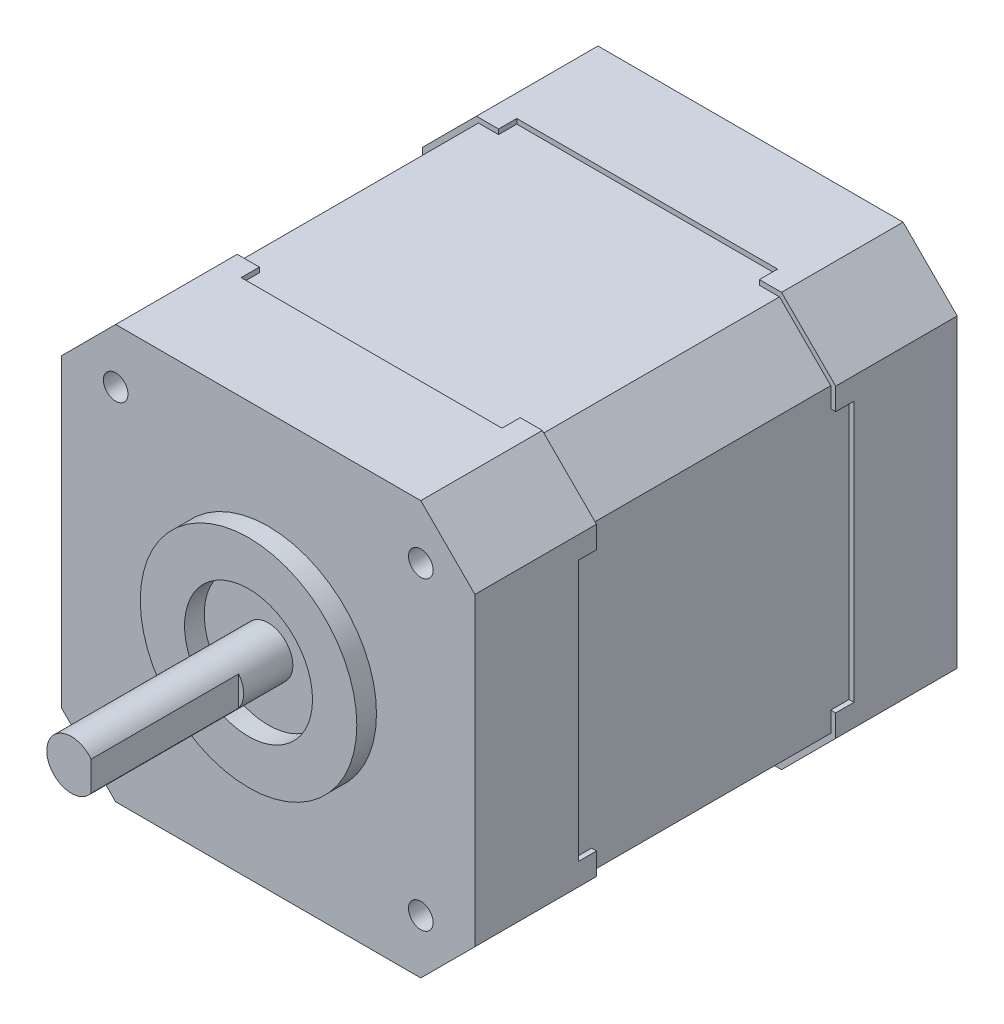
SolidWorks part; units mm, degrees
ref_plane "前基準面" through (0, 0, 0) normal (0, 0, 1) x (1, 0, 0)
ref_plane "上基準面" through (0, 0, 0) normal (0, 1, 0) x (1, 0, 0)
ref_plane "右基準面" through (0, 0, 0) normal (1, 0, 0) x (0, 0, -1)
sketch "草圖1" plane through (0, 0, 0) normal (0, 0, 1) x (1, 0, 0)
  line L0 (-21, 15.5) -> (-15.5, 21)
  line L1 (-15.5, 21) -> (15.5, 21)
  line L2 (-21, 15.5) -> (-21, -15.5)
  line L3 (-15.5, -21) -> (15.5, -21)
  line L4 (21, 15.5) -> (21, -15.5)
  line L5 (-18.25, 18.25) -> (18.25, -18.25) construction
  line L6 (-18.25, -18.25) -> (18.25, 18.25) construction
  line L7 (-21, -15.5) -> (-15.5, -21)
  line L8 (15.5, -21) -> (21, -15.5)
  line L9 (15.5, 21) -> (21, 15.5)
  point P0 (0, 0)
  dimension "D1" = 42
  dimension "D2" = 21
  dimension "D3" = 42
  dimension "D4" = 21
  dimension "D5" = 5.5
  dimension "D6" = 5.5
  dimension "D7" = 31
  dimension "D8" = 5.5
  dimension "D9" = 31
  dimension "D10" = 5.5
  dimension "D11" = 31
  dimension "D12" = 31
extrude "填料-伸長1" add sketch "草圖1" against normal blind 49
sketch "草圖2" plane through (0, 0, 0) normal (0, 0, 1) x (1, 0, 0)
  circle A0 centre (0, 0) radius 11
  circle A1 centre (0, 0) radius 6.5
  dimension "D1" = 22
  dimension "D2" = 13
extrude "填料-伸長2" add sketch "草圖2" along normal blind 2
sketch "草圖3" plane through (0, 0, 0) normal (0, 0, 1) x (1, 0, 0)
  circle A0 centre (0, 0) radius 2.5
  dimension "D1" = 5
extrude "填料-伸長3" add sketch "草圖3" along normal blind 20
sketch "草圖4" plane through (0, 0, 20) normal (0, 0, 1) x (1, 0, 0)
  line L0 (2, 1.5) -> (2, -1.5)
  arc A0 (2, -1.5) -> (2, 1.5) centre (0, 0) ccw
  dimension "D1" = 5
  dimension "D3" = 2
extrude "除料-伸長1" cut sketch "草圖4" against normal blind 15
ref_plane "平面1" through (0, 0, -12.35) normal (0, 0, 1) x (1, 0, 0)
sketch "草圖5" plane through (0, 0, -12.35) normal (0, 0, 1) x (1, 0, 0)
  line L0 (15.5, 21) -> (-15.5, 21) construction
  line L1 (21, 15.5) -> (15.5, 21) construction
  line L2 (21, -15.5) -> (21, 15.5) construction
  line L3 (15.5, -21) -> (21, -15.5) construction
  line L4 (-15.5, -21) -> (15.5, -21) construction
  line L5 (-21, -15.5) -> (-15.5, -21) construction
  line L6 (-21, 15.5) -> (-21, -15.5) construction
  line L7 (-15.5, 21) -> (-21, 15.5) construction
  line L8 (15.5, 21) -> (-15.5, 21)
  line L9 (21, 15.5) -> (15.5, 21)
  line L10 (21, -15.5) -> (21, 15.5)
  line L11 (15.5, -21) -> (21, -15.5)
  line L12 (-15.5, -21) -> (15.5, -21)
  line L13 (-21, -15.5) -> (-15.5, -21)
  line L14 (-21, 15.5) -> (-21, -15.5)
  line L15 (-15.5, 21) -> (-21, 15.5)
sketch "草圖6" plane through (0, 0, 0) normal (1, 0, 0) x (0, 0, -1)
  line L0 (12.35, 21) -> (12.35, 15.5) construction
  line L1 (12.35, 21) -> (36.65, 21)
  line L2 (12.35, 21) -> (12.35, 20.5)
  line L3 (12.35, 20.5) -> (36.65, 20.5)
  line L4 (36.65, 21) -> (36.65, 20.5)
  line L5 (49, 21) -> (0, 21) construction
  line L7 (49, 15.5) -> (49, 21) construction
  dimension "D1" = 0.5
  dimension "D2" = 12.35
sweep "除料-掃出1" cut profiles "草圖6" path "草圖5"
sketch "草圖7" plane through (0, 21, 0) normal (0, 1, 0) x (1, 0, 0)
  line L0 (15.5, 0) -> (-15.5, 0) construction
  line L1 (-13.25, 38.5) -> (13.25, 38.5)
  line L2 (-13.25, 38.5) -> (-13.25, 10.5)
  line L3 (-13.25, 10.5) -> (13.25, 10.5)
  line L4 (13.25, 38.5) -> (13.25, 10.5)
  line L6 (15.5, 49) -> (-15.5, 49) construction
  dimension "D1" = 10.5
  dimension "D2" = 26.5
  dimension "D3" = 13.25
  dimension "D4" = 10.5
extrude "除料-伸長2" cut sketch "草圖7" against normal up to surface (0.5 mm away)
sketch "草圖8" plane through (21, 0, 0) normal (1, 0, 0) x (0, 0, -1)
  line L0 (0, 11) -> (0, -11) construction
  line L1 (10.5, 13.25) -> (38.5, 13.25)
  line L2 (10.5, 13.25) -> (10.5, -13.25)
  line L3 (10.5, -13.25) -> (38.5, -13.25)
  line L4 (38.5, 13.25) -> (38.5, -13.25)
  line L5 (49, -15.5) -> (49, 15.5) construction
  dimension "D1" = 26.5
  dimension "D2" = 10.5
  dimension "D3" = 10.5
  dimension "D4" = 13.25
extrude "除料-伸長3" cut sketch "草圖8" against normal up to surface (0.5 mm away)
sketch "草圖9" plane through (0, -21, 0) normal (0, -1, 0) x (1, 0, 0)
  line L0 (-15.5, 0) -> (15.5, 0) construction
  line L1 (-13.25, -10.5) -> (13.25, -10.5)
  line L2 (-13.25, -10.5) -> (-13.25, -38.5)
  line L3 (-13.25, -38.5) -> (13.25, -38.5)
  line L4 (13.25, -10.5) -> (13.25, -38.5)
  line L5 (-15.5, -49) -> (15.5, -49) construction
  dimension "D1" = 13.25
  dimension "D2" = 26.5
  dimension "D3" = 10.5
  dimension "D4" = 10.5
extrude "除料-伸長4" cut sketch "草圖9" against normal up to surface (0.5 mm away)
sketch "草圖10" plane through (-21, 0, 0) normal (-1, 0, 0) x (0, 0, 1)
  line L0 (0, 15.5) -> (0, -15.5) construction
  line L1 (-38.5, 13.25) -> (-10.5, 13.25)
  line L2 (-38.5, 13.25) -> (-38.5, -13.25)
  line L3 (-38.5, -13.25) -> (-10.5, -13.25)
  line L4 (-10.5, 13.25) -> (-10.5, -13.25)
  line L5 (-49, 15.5) -> (-49, -15.5) construction
  dimension "D1" = 26.5
  dimension "D2" = 13.25
  dimension "D3" = 10.5
  dimension "D4" = 10.5
extrude "除料-伸長5" cut sketch "草圖10" against normal up to surface (0.5 mm away)
hole_wizard "M3 螺紋孔1" positions "草圖12" profile "草圖11" tap size "M3" standard "ISO"
sketch "草圖12" plane through (0, 0, 0) normal (0, 0, 1) x (1, 0, 0)
  point P1 (-15.5, 15.5)
  point P3 (15.5, 15.5)
  point P5 (15.5, -15.5)
  point P7 (-15.5, -15.5)
  dimension "D1" = 15.5
  dimension "D2" = 15.5
  dimension "D3" = 31
  dimension "D4" = 15.5
  dimension "D5" = 31
  dimension "D6" = 15.5
  dimension "D7" = 31
  dimension "D8" = 31
sketch "草圖11" plane through (-15.5, 15.5, 0) normal (1, 0, 0) x (0, -1, 0)
  line L0 (0, 0) -> (0, 5.2511)
  line L1 (0, 5.2511) -> (1.25, 4.5)
  line L2 (1.25, 4.5) -> (1.25, 0)
  line L5 (1.25, 0) -> (0, 0)
  line L10 (0, 5.2511) -> (-1.25, 4.5) construction
  line L11 (0, -6.35) -> (0, 107.95) construction
  dimension "螺孔鑽直徑" = 2.5
  dimension "螺孔鑽深度" = 4.5
  dimension "導頭角度" = 118
sketch "草圖13" plane through (0, 0, -49) normal (0, 0, -1) x (-1, 0, 0)
  circle A0 centre (0, 0) radius 2.5
  dimension "D1" = 5
extrude "填料-伸長4" add sketch "草圖13" along normal blind 15
chamfer "導角1" distance 0.5 angle 45 1 edges at (-2.5, 0, -64)
